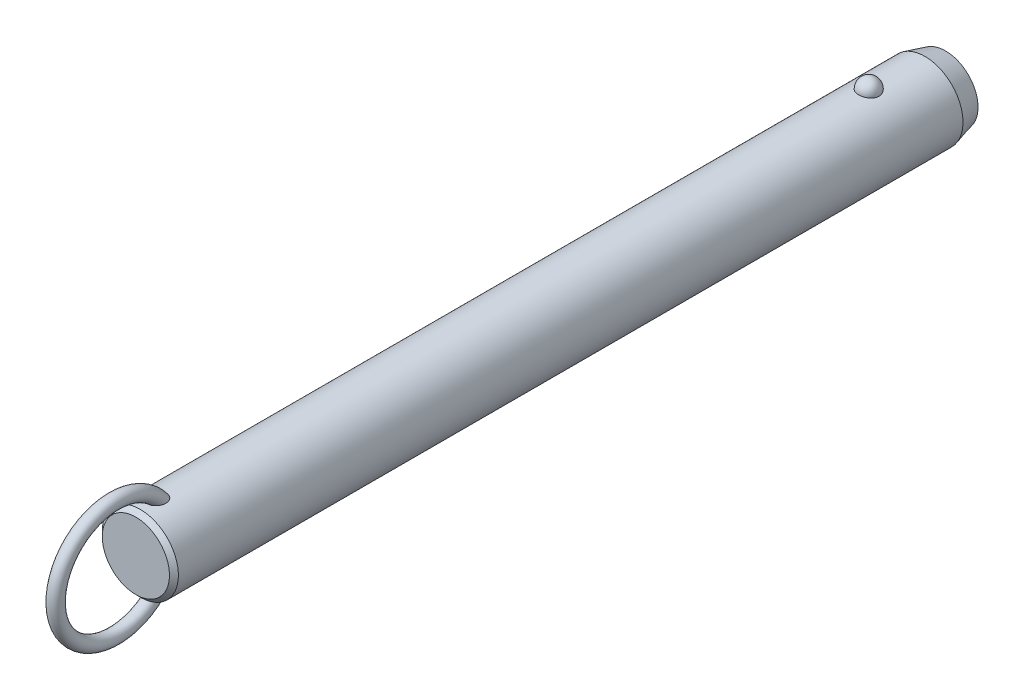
SolidWorks part; units mm, degrees
ref_plane "Front Plane" through (0, 0, 0) normal (0, 0, 1) x (1, 0, 0)
ref_plane "Top Plane" through (0, 0, 0) normal (0, 1, 0) x (1, 0, 0)
ref_plane "Right Plane" through (0, 0, 0) normal (1, 0, 0) x (0, 0, -1)
sketch "Sketch2" plane through (0, 0, 0) normal (0, 0, 1) x (1, 0, 0)
  circle A0 centre (0, 0) radius 11.1
  point P3 (0, 11.1)
  dimension "D1" = 22.2
extrude "Boss-Extrude1" add sketch "Sketch2" along normal blind 198.1
sketch "Sketch3" plane through (0, 0, 0) normal (0, 0, -1) x (-1, 0, 0)
  circle A0 centre (0, 0) radius 11.1
  dimension "D1" = 22.2
extrude "Boss-Extrude2" add sketch "Sketch3" along normal blind 25.4
chamfer "Chamfer1" distance 6 angle 15 1 edges at (-11.1, 0, -25.4)
sketch "Sketch12" plane through (0, 0, 0) normal (1, 0, 0) x (0, 0, -1)
  line L0 (-198.1, 11.1) -> (-198.1, -11.1) construction
  point P0 (-198.1, 0)
sketch "Sketch13" plane through (0, 0, 0) normal (1, 0, 0) x (0, 0, -1)
  circle A0 centre (-217.15, 0) radius 19.05
  point P2 (-198.1, 0)
  dimension "D1" = 38.1
sketch "Sketch14" plane through (0, 0, 0) normal (0, 1, 0) x (1, 0, 0)
  circle A0 centre (0, -200.1) radius 2
  point P2 (0, -198.1)
  dimension "D1" = 4
sweep "Sweep1" add profiles "Sketch14" path "Sketch13"
sketch "Sketch15" plane through (0, 0, 198.1) normal (0, 0, 1) x (1, 0, 0)
  circle A0 centre (0, 0) radius 11.1
  dimension "D1" = 22.2
extrude "Boss-Extrude3" add sketch "Sketch15" along normal blind 12.7
chamfer "Chamfer2" distance 1.3 angle 45 1 edges at (11.1, 0, 210.8)
sketch "Sketch18" plane through (0, 0, 0) normal (1, 0, 0) x (0, 0, -1)
  line L0 (19.4, 11.1) -> (-201.668, 11.1) construction
  line L1 (3, 14.1) -> (3, 8.1)
  line L2 (-201.668, -11.1) -> (19.4, -11.1) construction
  arc A0 (3, 14.1) -> (3, 8.1) centre (3, 11.1) ccw
  point P4 (0, 11.1)
  dimension "D1" = 25.2
revolve "Revolve1" add sketch "Sketch18" angle 360 about L1
